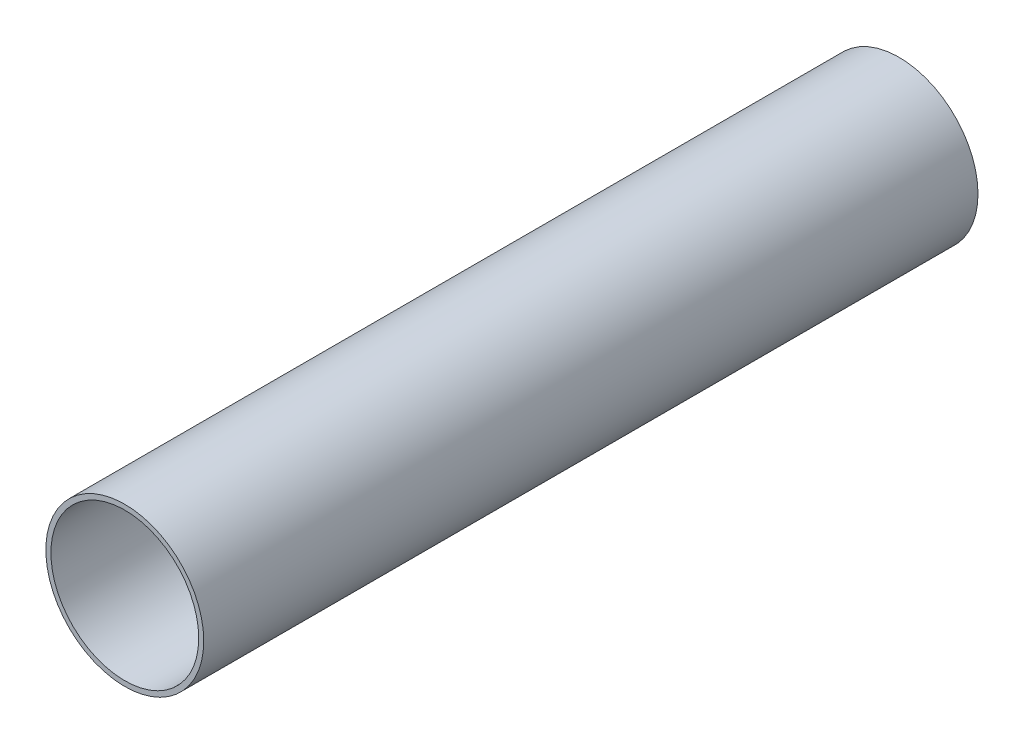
SolidWorks part; units mm, degrees
ref_plane "Front Plane" through (0, 0, 0) normal (0, 0, 1) x (1, 0, 0)
ref_plane "Top Plane" through (0, 0, 0) normal (0, 1, 0) x (1, 0, 0)
ref_plane "Right Plane" through (0, 0, 0) normal (1, 0, 0) x (0, 0, -1)
sketch "Sketch1" plane through (0, 0, 0) normal (0, 0, 1) x (1, 0, 0)
  circle A0 centre (-395, 0) radius 47 construction
  circle A1 centre (-395, 0) radius 47
extrude "Boss-Extrude1" add sketch "Sketch1" along normal up to surface (460.8891 mm away)
shell "Shell1" thickness 3
